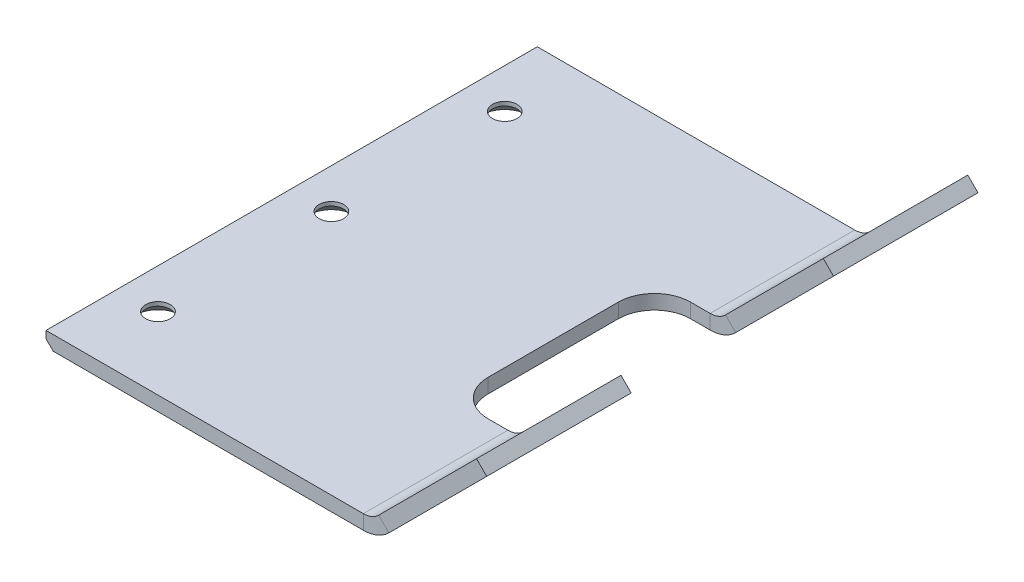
SolidWorks part; units mm, degrees
ref_plane "Face" through (0, 0, 0) normal (0, 0, 1) x (1, 0, 0)
ref_plane "Dessus" through (0, 0, 0) normal (0, 1, 0) x (1, 0, 0)
ref_plane "Profil" through (0, 0, 0) normal (1, 0, 0) x (0, 0, -1)
sketch "Esquisse1" plane through (0, 0, 0) normal (0, 0, 1) x (1, 0, 0)
  line L0 (0, 0) -> (43.9289, 0)
  line L1 (47.4645, 1.4645) -> (61, 15)
  arc A0 (43.9289, 0) -> (47.4645, 1.4645) centre (43.9289, 5) ccw
  dimension "D4" = 5
  dimension "D1" = 15
  dimension "D2" = 45
  dimension "D3" = 61
extrude "Extru.-Mince1" add sketch "Esquisse1" along normal mid plane 68 thin
sheet metal parameters "Tôlerie 1" parameters "D1"=2
bend "Pli issu d'un arrondi1" bend radius 3 bend angle 45 parameters "D5"=1
flatten bends "Dépliage 1" parameters "D1"=0
sketch "Esquisse-Angle1" plane through (0, 2, 0) normal (0, 1, 0) x (-1, 0, 0)
  line L0 (-45.4997, 34) -> (-45.4997, -34) construction
hole_wizard "Fraisage pour vis à tête fraisée M31" positions "Esquisse6" profile "Esquisse5" countersink size "M3" standard "DIN"
sketch "Esquisse6" plane through (0, 0, 0) normal (0, -1, 0) x (1, 0, 0)
  line L0 (0, 34) -> (43.9289, 34) construction
  line L1 (0, 34) -> (0, -34) construction
  point P0 (5.5, 24)
  dimension "D1" = 10
  dimension "D2" = 5.5
sketch "Esquisse5" plane through (5.5, 0, 24) normal (1, 0, 0) x (0, 0, -1)
  line L0 (0, 0) -> (0, 2)
  line L1 (0, 2) -> (1.7, 2)
  line L2 (1.7, 2) -> (1.7, 1.45)
  line L3 (1.7, 1.45) -> (3.15, 0)
  line L5 (3.15, 0) -> (0, 0)
  line L6 (-1.7, 1.45) -> (-3.15, 0) construction
  line L11 (0, -6.35) -> (0, 107.95) construction
  dimension "Diamètre du perçage jusqu'au prochain" = 3.4
  dimension "Profondeur du perçage jusqu'au prochain" = 2
  dimension "Diamètre du fraisage entrant" = 6.3
  dimension "Angle du fraisage entrant" = 90
pattern_linear "Répétition linéaire2" count 3 spacing 24 along (0, 0, -1) of "Fraisage pour vis à tête fraisée M31"
sketch "Esquisse7" plane through (0, 0, 0) normal (0, -1, 0) x (1, 0, 0)
  line L0 (-15.2521, 0) -> (86.8354, 0) construction
  line L1 (36.2127, -9) -> (36.2127, 9)
  line L2 (41.2127, 14) -> (66.2127, 14)
  line L3 (66.2127, 34) -> (66.2127, -34) construction
  line L4 (41.2127, -14) -> (66.2127, -14)
  arc A0 (36.2127, 9) -> (41.2127, 14) centre (41.2127, 9) cw
  arc A1 (41.2127, -14) -> (36.2127, -9) centre (41.2127, -9) cw
  point P9 (36.2127, 0)
  point P12 (36.2127, 14)
  point P15 (36.2127, -14)
  dimension "D1" = 5
  dimension "D2" = 30
  dimension "D3" = 28
extrude "Enlèv. mat.-Extru.1" cut sketch "Esquisse7" against normal through all and the other way through all flip side to cut
process bends "Pliage 1" parameters "D1"=0
sketch "Esquisse-Plate1" plane through (0, 2, 0) normal (0, 1, 0) x (-1, 0, 0)
chamfer "Chanfrein1" distance 1 angle 45 1 edges at (0, 0, 0)
